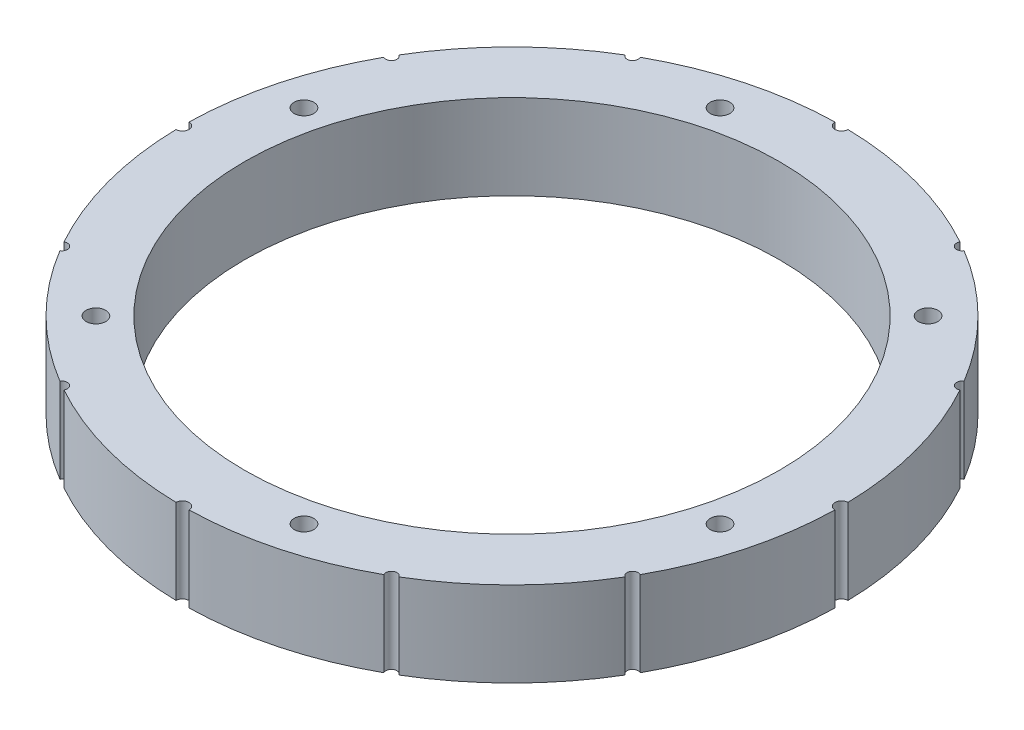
SolidWorks part; units mm, degrees
ref_plane "前视基准面" through (0, 0, 0) normal (0, 0, 1) x (1, 0, 0)
ref_plane "上视基准面" through (0, 0, 0) normal (0, 1, 0) x (1, 0, 0)
ref_plane "右视基准面" through (0, 0, 0) normal (1, 0, 0) x (0, 0, -1)
sketch "草图1" plane through (0, 0, 0) normal (0, 1, 0) x (1, 0, 0)
  circle A0 centre (0, 0) radius 40.9
  circle A1 centre (0, 0) radius 50.4
  dimension "D1" = 81.8
  dimension "D2" = 100.8
extrude "凸台-拉伸1" add sketch "草图1" against normal blind 13 contours A0
sketch "草图2" plane through (0, -13, 0) normal (0, -1, 0) x (1, 0, 0)
  line L0 (0, -75.2808) -> (0, 56.4382) construction
  circle A0 centre (0, 50.4) radius 1
  circle A1 centre (0, 0) radius 50.4 construction
  circle A2 centre (50.4, 0) radius 1
  circle A3 centre (0, -50.4) radius 1
  circle A4 centre (-50.4, 0) radius 1
  circle A5 centre (-25.2, 43.6477) radius 0.85
  circle A6 centre (25.2, 43.6477) radius 0.85
  circle A7 centre (43.6477, 25.2) radius 0.85
  circle A8 centre (43.6477, -25.2) radius 0.85
  circle A9 centre (25.2, -43.6477) radius 0.85
  circle A10 centre (-25.2, -43.6477) radius 0.85
  circle A11 centre (-43.6477, -25.2) radius 0.85
  circle A12 centre (-43.6477, 25.2) radius 0.85
  point P14 (0, 0)
  point P33 (0, 0)
  dimension "D1" = 2
  dimension "D3" = 1.7
  dimension "D4" = 30
  dimension "D2" = 4
  dimension "D5" = 4
extrude "切除-拉伸1" cut sketch "草图2" against normal blind 13
sketch "草图3" plane through (0, 0, 0) normal (0, 1, 0) x (1, 0, 0)
  line L0 (0, -59.1889) -> (0, 55.0049) construction
  line L1 (-11.6469, 43.4667) -> (0, 0) construction
  circle A0 centre (-11.6469, 43.4667) radius 1.5
  circle A2 centre (0, 0) radius 40.9 construction
  point P21 (0, 0)
  dimension "D1" = 3
  dimension "D2" = 45
  dimension "D3" = 15
extrude "切除-拉伸2" cut sketch "草图3" against normal blind 5
sketch "草图4" plane through (0, 0, 0) normal (1, 0, 0) x (0, 0, -1)
  line L0 (0, 10.2914) -> (0, -21.6359) construction
pattern_circular "阵列(圆周)1" count 6 over 360 about axis through (0, 0, 0) along (0, 1, 0) of "切除-拉伸2"
